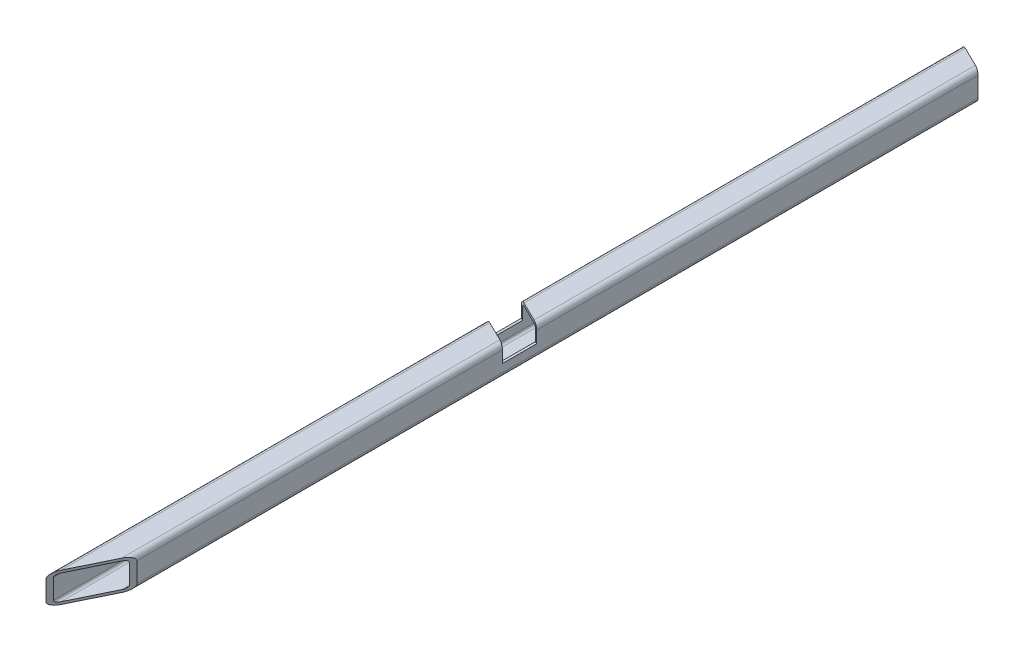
SolidWorks part; units mm, degrees
ref_plane "Plane1" through (0, 0, 0) normal (0, 0, 1) x (1, 0, 0)
ref_plane "Plane2" through (0, 0, 0) normal (0, 1, 0) x (1, 0, 0)
ref_plane "Plane3" through (0, 0, 0) normal (1, 0, 0) x (0, 0, -1)
sketch "Sketch1" plane through (0, 0, 0) normal (0, 0, 1) x (1, 0, 0)
  line L0 (-20, -25) -> (20, -25)
  line L1 (-25, -20) -> (-25, 20)
  line L2 (20, 25) -> (-20, 25)
  line L3 (25, 20) -> (25, -20)
  line L4 (-20, -30) -> (20, -30)
  line L5 (-30, -20) -> (-30, 20)
  line L6 (20, 30) -> (-20, 30)
  line L7 (30, 20) -> (30, -20)
  line L8 (-30, 0) -> (-25, 0) construction
  line L9 (-25, 0) -> (25, 0) construction
  line L10 (25, 0) -> (30, 0) construction
  line L12 (0, 30) -> (0, 25) construction
  line L13 (0, 25) -> (0, -25) construction
  line L14 (0, -25) -> (0, -30) construction
  arc A0 (30, 20) -> (20, 30) centre (20, 20) ccw
  arc A1 (20, -30) -> (30, -20) centre (20, -20) ccw
  arc A2 (-30, -20) -> (-20, -30) centre (-20, -20) ccw
  arc A3 (-20, 30) -> (-30, 20) centre (-20, 20) ccw
  arc A4 (-20, 25) -> (-25, 20) centre (-20, 20) ccw
  arc A5 (25, 20) -> (20, 25) centre (20, 20) ccw
  arc A6 (20, -25) -> (25, -20) centre (20, -20) ccw
  arc A7 (-25, -20) -> (-20, -25) centre (-20, -20) ccw
  point P2 (-30, 30)
  point P33 (-30, -30)
  point P34 (30, -30)
  point P36 (30, 30)
extrude "Extrusion1" add sketch "Sketch1" along normal blind 1847.32
sketch "Esquisse1" plane through (0, 30, 0) normal (0, 1, 0) x (-1, 0, 0)
  line L0 (-30, 1847.32) -> (30, 1847.32)
  line L1 (30, 1847.32) -> (-30, 1724.3018)
  line L2 (-30, 1724.3018) -> (-30, 1847.32)
  line L3 (-20, 1847.32) -> (20, 1847.32) construction
  line L4 (-30, 1847.32) -> (-30, 0) construction
  line L5 (30, 1847.32) -> (30, 0) construction
  dimension "D1" = 64
extrude "Extrusion2" cut sketch "Esquisse1" against normal through all
sketch "Esquisse2" plane through (0, 30, 0) normal (0, 1, 0) x (1, 0, 0)
  line L0 (-30, 0) -> (30, 0)
  line L1 (-30, 0) -> (30, -29.264)
  line L2 (30, -29.264) -> (30, 0)
  line L3 (-30, -1847.32) -> (-30, 0) construction
  line L4 (30, -1724.3018) -> (30, 0) construction
  dimension "D1" = 26
extrude "Extrusion3" cut sketch "Esquisse2" against normal through all
sketch "Esquisse3" plane through (0, 30, 0) normal (0, 1, 0) x (-1, 0, 0)
  line L0 (120.1505, 914.3817) -> (-104.548, 1023.9745)
  line L1 (120.1505, 914.3817) -> (92.9715, 858.6565)
  line L2 (-104.548, 1023.9745) -> (-131.727, 968.2493)
  line L3 (92.9715, 858.6565) -> (-131.727, 968.2493)
  line L5 (-20, 1744.8048) -> (20, 1826.817) construction
  dimension "D1" = 62
  dimension "D2" = 799
  dimension "D3" = 250
  dimension "D4" = 240
extrude "Extrusion4" cut sketch "Esquisse3" against normal blind 34
